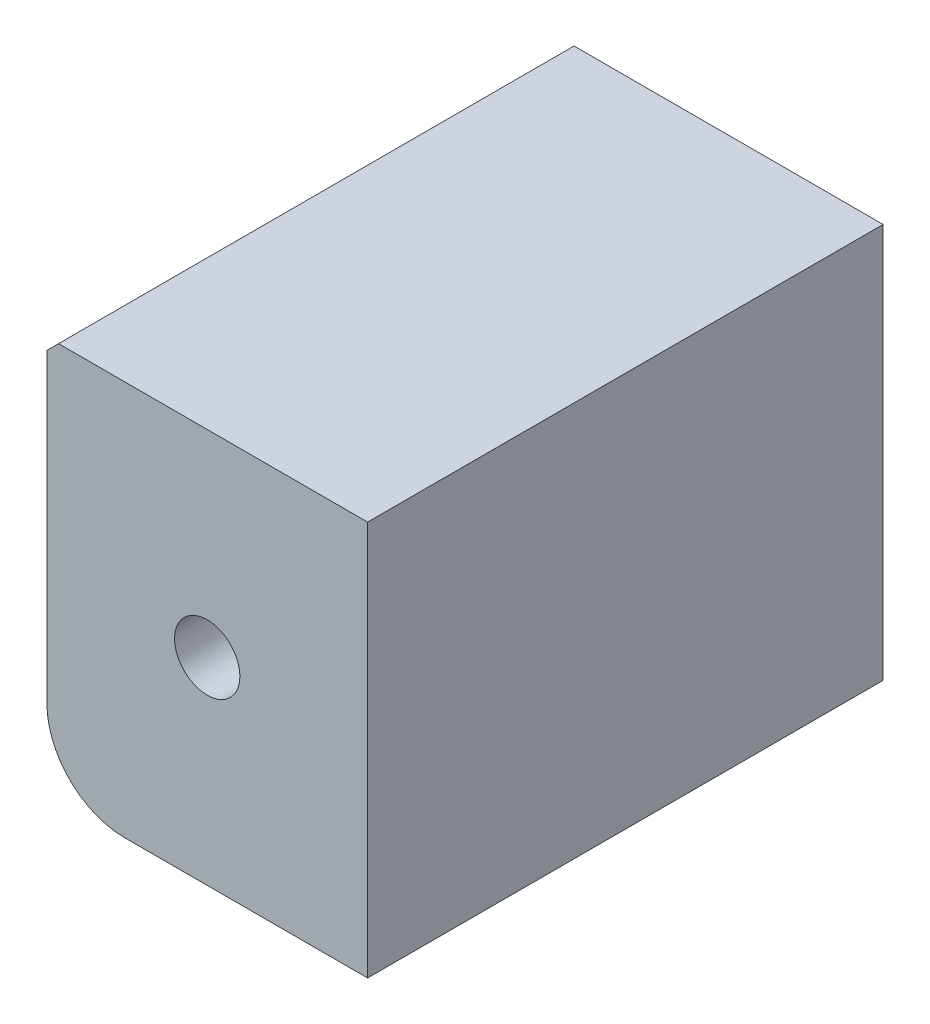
SolidWorks part; units mm, degrees
ref_plane "Front Plane" through (0, 0, 0) normal (0, 0, 1) x (1, 0, 0)
ref_plane "Top Plane" through (0, 0, 0) normal (0, 1, 0) x (1, 0, 0)
ref_plane "Right Plane" through (0, 0, 0) normal (1, 0, 0) x (0, 0, -1)
sketch "Sketch1" plane through (0, 0, 0) normal (0, 0, 1) x (1, 0, 0)
  line L1 (0, -50.8) -> (0, 0)
  line L3 (-31.27, -50.8) -> (0, -50.8)
  line L4 (-41.27, -40.8) -> (-41.27, 0)
  line L5 (-41.27, 0) -> (0, 0)
  arc A1 (-41.27, -40.8) -> (-31.27, -50.8) centre (-31.27, -40.8) ccw
  point P3 (-41.27, -50.8)
  dimension "D1" = 10
  dimension "D2" = 41.27
  dimension "D3" = 50.8
  dimension "D4" = 90
  dimension "D5" = 90
  dimension "D6" = 90
extrude "Extrude1" add sketch "Sketch1" along normal blind 66.33
sketch "Sketch2" plane through (0, 0, 66.33) normal (0, 0, 1) x (1, 0, 0)
  circle A0 centre (-20.635, -25.4) radius 4.2
  dimension "D1" = 8.4
  dimension "D2" = 20.635
  dimension "D3" = 25.4
extrude "Cut-Extrude1" cut sketch "Sketch2" against normal blind 22
sketch "Sketch4" plane through (0, 0, 0) normal (0, 0, -1) x (-1, 0, 0)
  line L0 (20.635, -25.4) -> (20.635, -53.4283) construction
  circle A1 centre (20.635, -39.4) radius 3
  dimension "D1" = 6
  dimension "D2" = 14
sketch "Sketch6" plane through (0, 0, 0) normal (0, 0, -1) x (-1, 0, 0)
  circle A0 centre (20.635, -25.4) radius 4.2
  dimension "D1" = 8.4
  dimension "D2" = 20.635
  dimension "D3" = 25.4
extrude "Cut-Extrude5" cut sketch "Sketch6" against normal blind 22
sketch "Sketch7" plane through (0, 0, 22) normal (0, 0, -1) x (-1, 0, 0)
  circle A1 centre (20.635, -25.4) radius 4.2
  circle A2 centre (20.635, -25.4) radius 4.2
  dimension "D1" = 0
extrude "Cut-Extrude6" cut sketch "Sketch7" against normal through all draft 60
sketch "Sketch8" plane through (0, 0, 0) normal (0, 0, -1) x (-1, 0, 0)
  circle A0 centre (20.635, -25.4) radius 9.01
  dimension "D1" = 25.4
  dimension "D3" = 18.02
  dimension "D2" = 20.635
extrude "Cut-Extrude7" cut sketch "Sketch8" against normal blind 8
extrude "Cut-Extrude8" cut sketch "Sketch4" against normal blind 8
chamfer "Chamfer1" distance 1.5 angle 45 1 edges at (-41.27, 0, 33.165)
